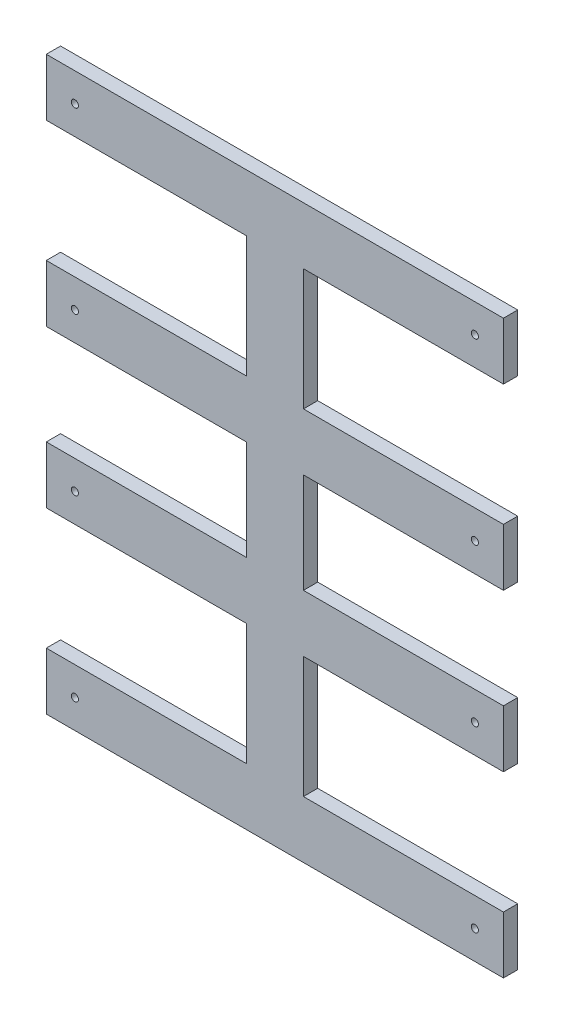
SolidWorks part; units mm, degrees
ref_plane "Front" through (0, 0, 0) normal (0, 0, 1) x (1, 0, 0)
ref_plane "Top" through (0, 0, 0) normal (0, 1, 0) x (1, 0, 0)
ref_plane "Right" through (0, 0, 0) normal (1, 0, 0) x (0, 0, -1)
sketch "스케치1" plane through (0, 0, 0) normal (0, 0, 1) x (1, 0, 0)
  line L0 (-105.1923, 0) -> (129.3412, 0) construction
  line L5 (0, 114.3) -> (0, -99.1321) construction
  line L6 (-12.7, 101.6) -> (-101.6, 101.6)
  line L27 (0, 114.3) -> (0, -114.3) construction
  line L28 (12.7, 0) -> (-12.7, 0) construction
  line L29 (101.6, 101.6) -> (12.7, 101.6)
  line L42 (101.6, 101.6) -> (101.6, 127)
  line L43 (101.6, 127) -> (-101.6, 127)
  line L44 (-101.6, 101.6) -> (-101.6, 127)
  line L45 (0, 127) -> (0, 101.6) construction
  line L46 (101.6, 114.3) -> (-101.6, 114.3) construction
  line L47 (101.6, 22.225) -> (12.7, 22.225)
  line L48 (101.6, 22.225) -> (101.6, 47.625)
  line L49 (101.6, 47.625) -> (12.7, 47.625)
  line L50 (-101.6, 22.225) -> (-101.6, 47.625)
  line L51 (0, 50.8) -> (0, 25.4) construction
  line L52 (101.6, 34.925) -> (-101.6, 34.925) construction
  line L53 (-12.7, 47.625) -> (-101.6, 47.625)
  line L54 (12.7, 47.625) -> (12.7, 101.6)
  line L55 (-12.7, 22.225) -> (-101.6, 22.225)
  line L56 (-12.7, 47.625) -> (-12.7, 101.6)
  line L57 (101.6, -34.925) -> (-101.6, -34.925) construction
  line L58 (0, -50.8) -> (0, -25.4) construction
  line L59 (101.6, -114.3) -> (-101.6, -114.3) construction
  line L60 (0, -127) -> (0, -101.6) construction
  line L61 (-12.7, -47.625) -> (-12.7, -101.6)
  line L62 (-12.7, -22.225) -> (-101.6, -22.225)
  line L63 (12.7, -47.625) -> (12.7, -101.6)
  line L64 (-12.7, -47.625) -> (-101.6, -47.625)
  line L65 (-101.6, -22.225) -> (-101.6, -47.625)
  line L66 (101.6, -47.625) -> (12.7, -47.625)
  line L67 (101.6, -22.225) -> (101.6, -47.625)
  line L68 (101.6, -22.225) -> (12.7, -22.225)
  line L69 (-101.6, -101.6) -> (-101.6, -127)
  line L70 (101.6, -127) -> (-101.6, -127)
  line L71 (101.6, -101.6) -> (101.6, -127)
  line L72 (101.6, -101.6) -> (12.7, -101.6)
  line L73 (-12.7, -101.6) -> (-101.6, -101.6)
  line L74 (12.7, -22.225) -> (12.7, 22.225)
  line L75 (-12.7, -22.225) -> (-12.7, 22.225)
  circle A8 centre (-88.9, 114.3) radius 1.5875
  circle A9 centre (88.9, 114.3) radius 1.5875
  circle A10 centre (88.9, 34.925) radius 1.5875
  circle A11 centre (-88.9, 34.925) radius 1.5875
  circle A12 centre (-88.9, -34.925) radius 1.5875
  circle A13 centre (88.9, -34.925) radius 1.5875
  circle A14 centre (88.9, -114.3) radius 1.5875
  circle A15 centre (-88.9, -114.3) radius 1.5875
  point P4 (0, 0)
  point P11 (0, 34.925)
  point P69 (0, -34.925)
  dimension "D3" = 203.2
  dimension "D5" = 25.4
  dimension "D6" = 53.975
  dimension "D8" = 12.7
  dimension "D13" = 3.175
  dimension "D14" = 3.175
  dimension "D15" = 3.175
  dimension "D16" = 3.175
  dimension "D1" = 127
  dimension "D2" = 203.2
  dimension "D4" = 25.4
  dimension "D9" = 12.7
  dimension "D10" = 12.7
  dimension "D11" = 12.7
  dimension "D12" = 12.7
extrude "보스-돌출1" add sketch "스케치1" along normal blind 6.35
